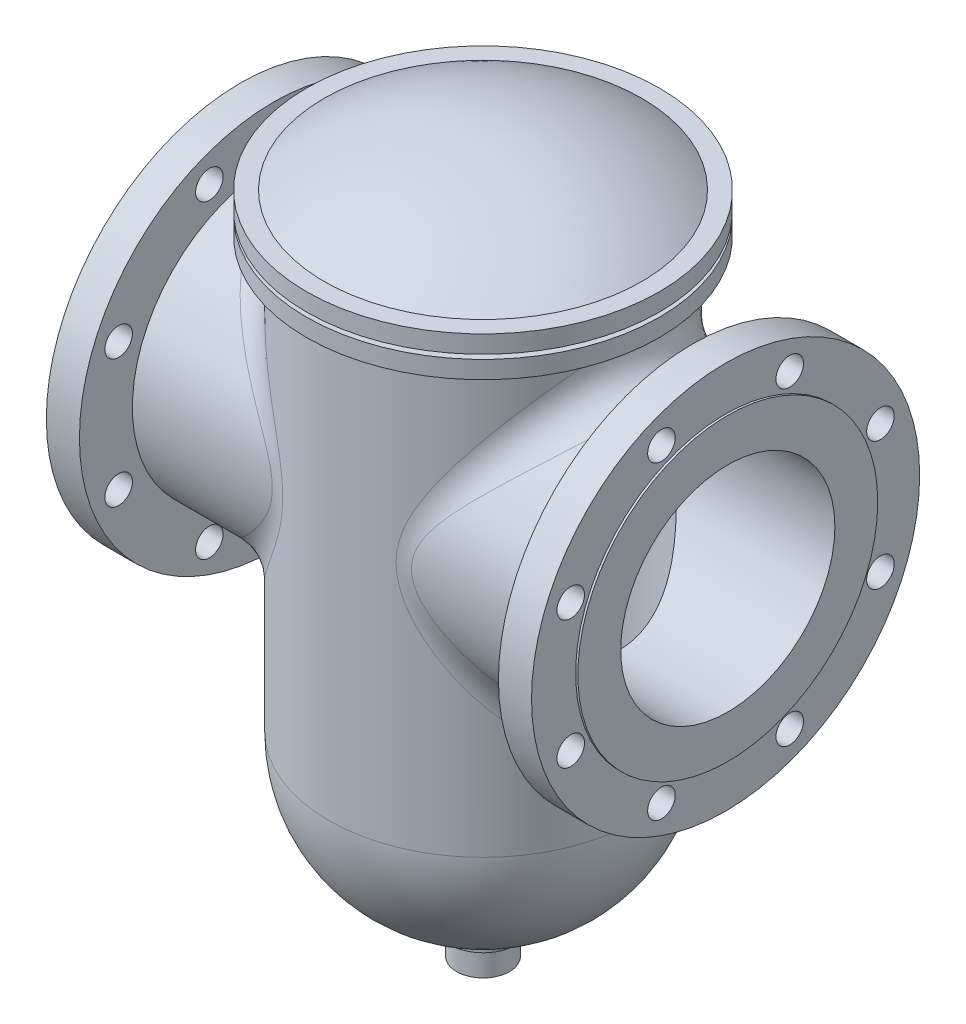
SolidWorks part; units mm, degrees
ref_plane "Front Plane" through (0, 0, 0) normal (0, 0, 1) x (1, 0, 0)
ref_plane "Top Plane" through (0, 0, 0) normal (0, 1, 0) x (1, 0, 0)
ref_plane "Right Plane" through (0, 0, 0) normal (1, 0, 0) x (0, 0, -1)
imported_body "Imported4"
imported_body "Imported5"
hole_wizard "3/4 Clearance Hole1" positions "Sketch6" profile "Sketch5" hole size "3/4" standard "Ansi Inch"
sketch "Sketch6" plane through (174.625, 0, 0) normal (1, 0, 0) x (0, 0, -1)
  line L0 (0, 0) -> (0, 201.4581) construction
  line L3 (-46.1708, 111.4661) -> (0, 0) construction
  circle A0 centre (0, 0) radius 120.65 construction
  point P0 (-46.1708, 111.4661)
  dimension "D1" = 241.3
  dimension "D2" = 22.5
sketch "Sketch5" plane through (174.625, 111.4661, 46.1708) normal (0, 1, 0) x (0, 0, -1)
  line L0 (0, 0) -> (0, 87.7012)
  line L1 (0, 87.7012) -> (9.9212, 87.7012)
  line L2 (9.9212, 87.7012) -> (9.9212, 0)
  line L5 (9.9212, 0) -> (0, 0)
  line L11 (0, -6.35) -> (0, 107.95) construction
  dimension "Thru Hole Dia." = 19.8425
  dimension "Thru Hole Depth" = 87.7012
hole_wizard "3/4 Clearance Hole2" positions "Sketch8" profile "Sketch7" hole size "3/4" standard "Ansi Inch"
sketch "Sketch8" plane through (-174.625, 12.3408, 53.1853) normal (1, 0, 0) x (0, 0, -1)
  circle A1 centre (7.0146, 99.1253) radius 9.9212 construction
  point P0 (7.0146, 99.1253)
sketch "Sketch7" plane through (-174.625, 111.4661, 46.1708) normal (0, 1, 0) x (0, 0, 1)
  line L0 (0, 0) -> (0, 87.7012)
  line L1 (0, 87.7012) -> (9.9212, 87.7012)
  line L2 (9.9212, 87.7012) -> (9.9212, 0)
  line L5 (9.9212, 0) -> (0, 0)
  line L11 (0, -6.35) -> (0, 107.95) construction
  dimension "Thru Hole Dia." = 19.8425
  dimension "Thru Hole Depth" = 87.7012
pattern_circular "CirPattern1" count 8 over 360 about axis through (0, 0, 0) along (1, 0, 0) of "3/4 Clearance Hole2", "3/4 Clearance Hole1"
